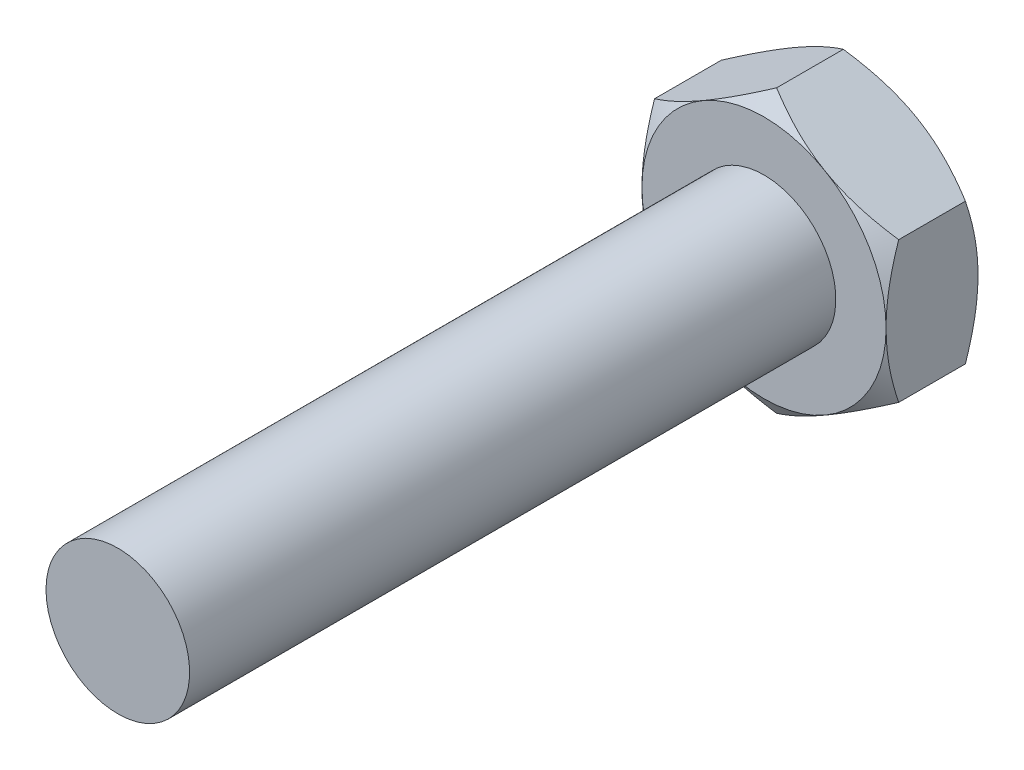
SolidWorks part; units mm, degrees
ref_plane "Ebene vorne" through (0, 0, 0) normal (0, 0, 1) x (1, 0, 0)
ref_plane "Ebene oben" through (0, 0, 0) normal (0, 1, 0) x (1, 0, 0)
ref_plane "Ebene rechts" through (0, 0, 0) normal (1, 0, 0) x (0, 0, -1)
sketch "Skizze1" plane through (0, 0, 0) normal (0, 0, 1) x (1, 0, 0)
  line L1 (8.5, 4.9075) -> (0, 9.815)
  line L2 (0, 9.815) -> (-8.5, 4.9075)
  line L3 (-8.5, 4.9075) -> (-8.5, -4.9075)
  line L4 (-8.5, -4.9075) -> (0, -9.815)
  line L5 (0, -9.815) -> (8.5, -4.9075)
  line L6 (8.5, -4.9075) -> (8.5, 4.9075)
  circle A0 centre (0, 0) radius 8.5 construction
  dimension "D1" = 17
extrude "Aufsatz-Linear austragen1" add sketch "Skizze1" along normal blind 6.4
sketch "Skizze2" plane through (0, 0, 6.4) normal (0, 0, 1) x (1, 0, 0)
  circle A0 centre (0, 0) radius 5
  dimension "D1" = 10
extrude "Aufsatz-Linear austragen2" add sketch "Skizze2" along normal blind 45
sketch "Skizze3" plane through (0, 0, 0) normal (0, 1, 0) x (1, 0, 0)
  line L0 (-11.5, -2) -> (-8.5, 0)
  line L1 (0, 0) -> (-8.5, 0) construction
  line L2 (-8.5, 0) -> (-11.5, 0)
  line L3 (-11.5, 0) -> (-11.5, -2)
  line L5 (0, 0) -> (0, -13.3515) construction
  line L6 (-16.6517, -3.2) -> (-3.7098, -3.2) construction
  line L7 (0, -6.4) -> (-8.5, -6.4) construction
  line L8 (-11.5, -6.4) -> (-11.5, -4.4)
  line L9 (-8.5, -6.4) -> (-11.5, -6.4)
  line L10 (-11.5, -4.4) -> (-8.5, -6.4)
  dimension "D1" = 2
  dimension "D2" = 11.5
  dimension "D3" = 8.5
revolve "Schnitt-Rotation1" cut sketch "Skizze3" angle 360 about L5
